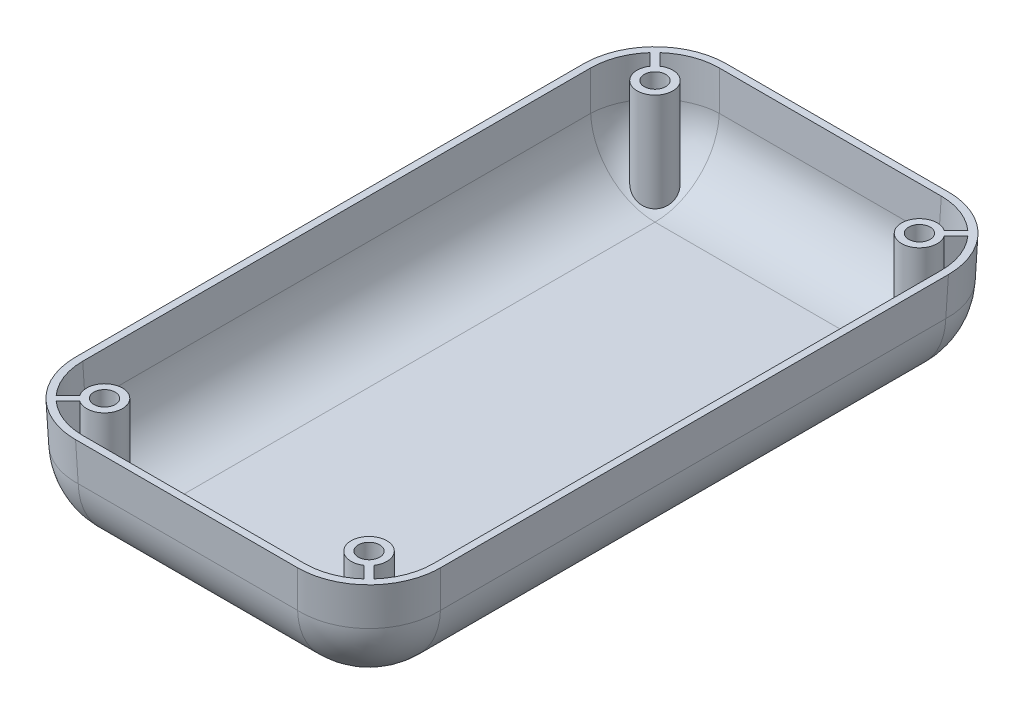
SolidWorks part; units mm, degrees
ref_plane "Vorne" through (0, 0, 0) normal (0, 0, 1) x (1, 0, 0)
ref_plane "Oben" through (0, 0, 0) normal (0, 1, 0) x (1, 0, 0)
ref_plane "Rechts" through (0, 0, 0) normal (1, 0, 0) x (0, 0, -1)
sketch "Skizze1" plane through (0, 0, 0) normal (0, 1, 0) x (1, 0, 0)
  line L1 (-25, 45) -> (25, 45)
  line L2 (-25, 45) -> (-25, -45)
  line L3 (-25, -45) -> (25, -45)
  line L4 (25, 45) -> (25, -45)
  line L5 (-25, 45) -> (25, -45) construction
  line L6 (-25, -45) -> (25, 45) construction
  point P0 (0, 0)
  dimension "D1" = 50
  dimension "D2" = 90
extrude "Linear austragen1" add sketch "Skizze1" along normal blind 15 draft 2
fillet "Verrundung2" radius 10 8 edges at (0, 0, -45) (-25, 0, 0) (0, 0, 45) (25, 0, 0) (-25.2619, 7.5, 45.2619) (-25.2619, 7.5, -45.2619) (25.2619, 7.5, -45.2619) (25.2619, 7.5, 45.2619)
shell "Wandung9" thickness 1
sketch "Skizze4" plane through (0, 15, 0) normal (0, 1, 0) x (1, 0, 0)
  line L4 (-18.5, 38.5) -> (-21.8894, 41.8894) construction
  line L5 (-19.8785, 40.5856) -> (-21.5359, 42.243)
  line L6 (-20.5856, 39.8785) -> (-22.243, 41.5359)
  line L7 (-18.1464, 38.8536) -> (-21.5359, 42.243) construction
  line L8 (-18.5, 38.5) -> (-18.5, -38.5)
  line L9 (18.5, 38.5) -> (-18.5, 38.5)
  line L10 (18.5, -38.5) -> (18.5, 38.5)
  line L11 (-18.5, -38.5) -> (18.5, -38.5)
  line L12 (-18.5, 38.5) -> (-18.5, -38.5) construction
  line L13 (18.5, 38.5) -> (-18.5, 38.5) construction
  line L14 (18.5, -38.5) -> (18.5, 38.5) construction
  line L15 (-18.5, -38.5) -> (18.5, -38.5) construction
  line L16 (-18.8536, 38.1464) -> (-22.243, 41.5359) construction
  line L17 (0, 0) -> (0, 38.5) construction
  line L18 (0, 0) -> (-18.5, 0) construction
  line L19 (18.5, 38.5) -> (21.8894, 41.8894) construction
  line L20 (20.5856, 39.8785) -> (22.243, 41.5359)
  line L21 (19.8785, 40.5856) -> (21.5359, 42.243)
  line L22 (18.5, -38.5) -> (21.8894, -41.8894) construction
  line L23 (-18.5, -38.5) -> (-21.8894, -41.8894) construction
  line L24 (19.8785, -40.5856) -> (21.5359, -42.243)
  line L25 (20.5856, -39.8785) -> (22.243, -41.5359)
  line L26 (-20.5856, -39.8785) -> (-22.243, -41.5359)
  line L27 (-19.8785, -40.5856) -> (-21.5359, -42.243)
  arc A0 (-20.5856, 39.8785) -> (-19.8785, 40.5856) centre (-18.5, 38.5) ccw
  circle A3 centre (-18.5, 38.5) radius 2.5 construction
  arc A4 (-21.5359, 42.243) -> (-22.243, 41.5359) centre (-21.8894, 41.8894) ccw
  circle A5 centre (-18.5, 38.5) radius 1.5
  circle A6 centre (18.5, 38.5) radius 1.5
  arc A7 (21.5359, 42.243) -> (22.243, 41.5359) centre (21.8894, 41.8894) cw
  arc A8 (20.5856, 39.8785) -> (19.8785, 40.5856) centre (18.5, 38.5) cw
  arc A9 (20.5856, -39.8785) -> (19.8785, -40.5856) centre (18.5, -38.5) ccw
  arc A10 (21.5359, -42.243) -> (22.243, -41.5359) centre (21.8894, -41.8894) ccw
  circle A11 centre (18.5, -38.5) radius 1.5
  circle A12 centre (-18.5, -38.5) radius 1.5
  arc A13 (-21.5359, -42.243) -> (-22.243, -41.5359) centre (-21.8894, -41.8894) cw
  arc A14 (-20.5856, -39.8785) -> (-19.8785, -40.5856) centre (-18.5, -38.5) cw
  ellipse E0 centre (-15.5177, 35.5177) end of major axis (-21.8894, 41.8894) minor radius 9 (-15.5287, 44.5232) -> (-24.5232, 35.5287) ccw construction
  dimension "D4" = 5
  dimension "D1" = 6.5
  dimension "D2" = 0.5
  dimension "D3" = 0.5
  dimension "D5" = 1
extrude "Linear austragen2" add sketch "Skizze4" against normal up to body
